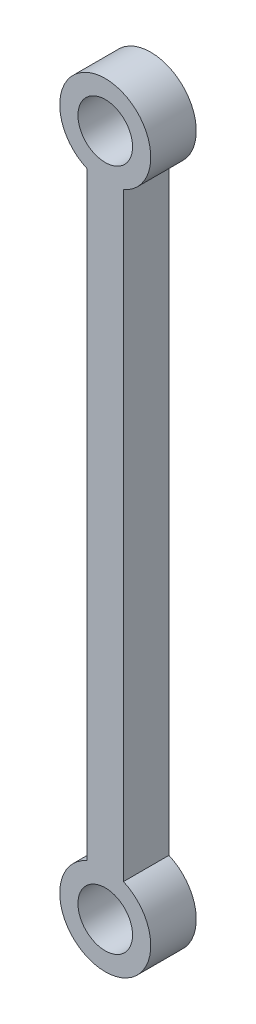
SolidWorks part; units mm, degrees
ref_plane "Front Plane" through (0, 0, 0) normal (0, 0, 1) x (1, 0, 0)
ref_plane "Top Plane" through (0, 0, 0) normal (0, 1, 0) x (1, 0, 0)
ref_plane "Right Plane" through (0, 0, 0) normal (1, 0, 0) x (0, 0, -1)
sketch "Sketch1" plane through (0, 0, 0) normal (0, 0, 1) x (1, 0, 0)
sketch_block_instance "Block-Piston_rod-1"
sketch_block "Block-Piston_rod" parameters "D1"=5, "D2"=6, "D3"=75, "D4"=4
extrude "Boss-Extrude1" add sketch "Sketch1" along normal blind 5
